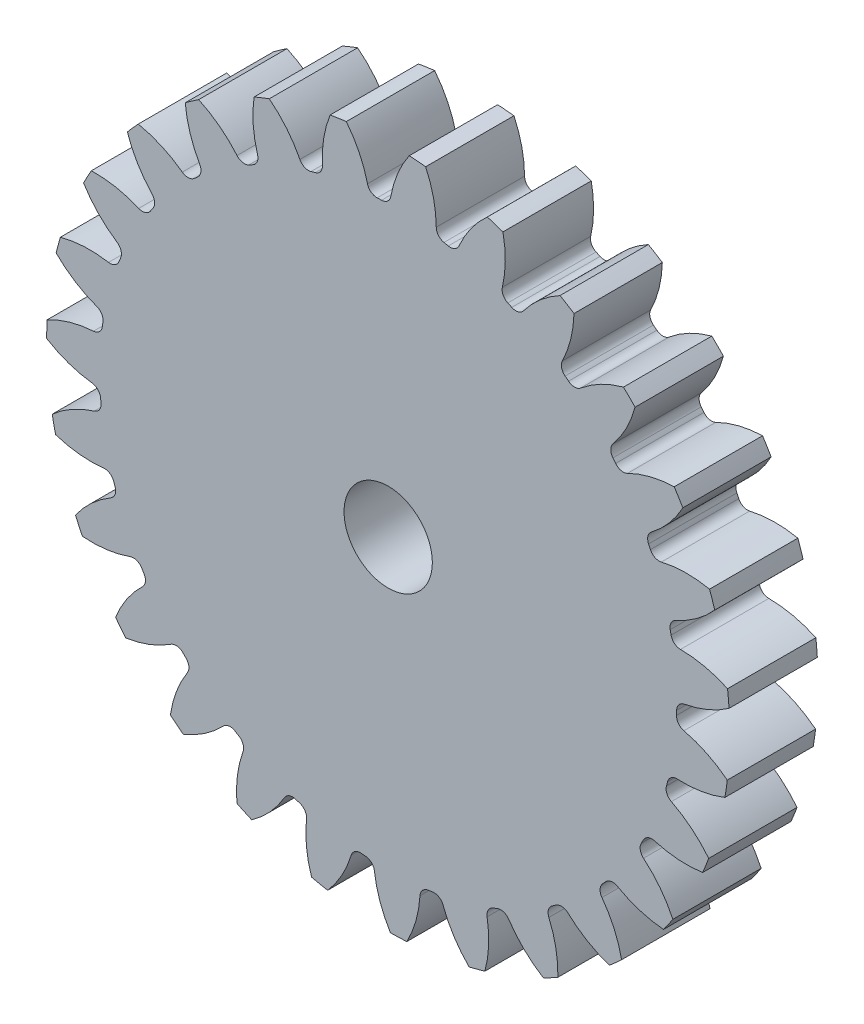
SolidWorks part; units mm, degrees
ref_plane "Front" through (0, 0, 0) normal (0, 0, 1) x (1, 0, 0)
ref_plane "Top" through (0, 0, 0) normal (0, 1, 0) x (1, 0, 0)
ref_plane "Right" through (0, 0, 0) normal (1, 0, 0) x (0, 0, -1)
sketch "Sketch3" plane through (0, 0, 0) normal (0, 0, 1) x (1, 0, 0)
  circle A0 centre (0, 0) radius 491.0667
  dimension "od" = 982.1333
extrude "gearBody" add sketch "Sketch3" along normal blind 127
sketch "Sketch2" plane through (0, 0, 0) normal (0, 0, 1) x (1, 0, 0)
  line L0 (0, 0) -> (396.924, 164.4113) construction
  line L1 (488.5191, -59.5764) -> (0, 0) construction
  line L2 (0, 0) -> (36.3143, 0) construction
  line L3 (456.9898, 13.8608) -> (455.5234, -39.1184) construction
  line L5 (456.2566, -12.6288) -> (0, 0) construction
  line L7 (0, 0) -> (429.6275, 0) construction
  arc A0 (429.5904, 5.6465) -> (428.6203, -29.401) centre (0, 0) ccw construction
  arc A1 (490.0401, 31.7359) -> (487.5343, -58.7943) centre (0, 0) ccw construction
  arc A2 (456.9898, 13.8608) -> (455.5234, -39.1184) centre (0, 0) ccw construction
  arc A3 (414.6083, -14.6396) -> (414.7833, -8.3172) centre (0, 0) ccw
  arc A4 (488.5191, -59.5764) -> (425.1575, -28.5269) centre (387.2217, -186.1158) ccw
  arc A5 (488.5191, -59.5764) -> (491.0667, 32.4624) centre (0, 0) ccw
  arc A6 (491.0667, 32.4624) -> (426.0845, 4.9653) centre (396.924, 164.4113) cw
  arc A7 (414.7833, -8.3172) -> (426.0845, 4.9653) centre (428.5643, -8.5935) cw
  arc A8 (425.1575, -28.5269) -> (414.6083, -14.6396) centre (428.3834, -15.126) cw
  point P6 (491.0667, 32.4624)
  point P22 (488.5191, -59.5764)
  dimension "baseDia" = 859.2549
  dimension "od" = 982.1333
  dimension "pd" = 914.4
  dimension "rd" = 829.7333
  dimension "rFillet" = 13.7837
  dimension "pointX" = 491.0667
  dimension "pointY" = 32.4624
  dimension "CTT" = 52.9791
  dimension "flankCenterAngle" = 22.5
extrude "toothCut" cut sketch "Sketch2" along normal through all
pattern_circular "CirPattern1" count 27 over 360 about axis through (0, 0, 0) along (0, 0, 1) of "toothCut"
sketch "hub1Dia" plane through (0, 0, 0) normal (0, 0, -1) x (-1, 0, 0)
  circle A0 centre (0, 0) radius 12.7
  dimension "hub1Dia" = 25.4
sketch "hub2Dia" plane through (0, 0, 127) normal (0, 0, 1) x (1, 0, 0)
  circle A0 centre (0, 0) radius 12.7
  dimension "hub2dia" = 25.4
sketch "boreDia" plane through (0, 0, 0) normal (0, 0, 1) x (1, 0, 0)
  circle A0 centre (0, 0) radius 63.5
  dimension "boreDia" = 127
extrude "bore" cut sketch "boreDia" against normal mid plane 25400
